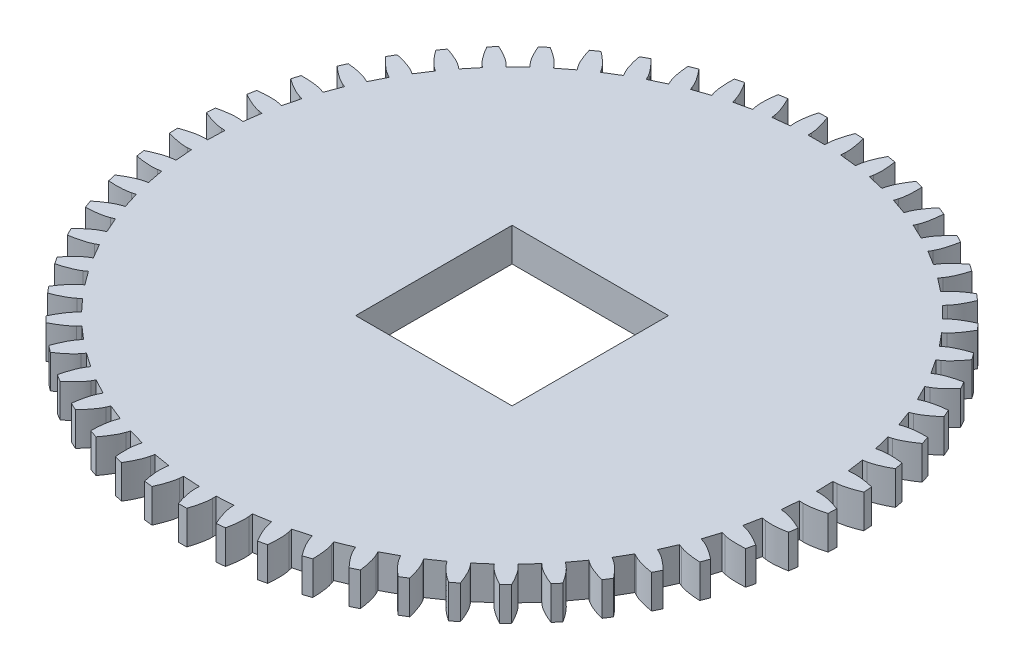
SolidWorks part; units mm, degrees
ref_plane "Front Plane" through (0, 0, 0) normal (0, 0, 1) x (1, 0, 0)
ref_plane "Top Plane" through (0, 0, 0) normal (0, 1, 0) x (1, 0, 0)
ref_plane "Right Plane" through (0, 0, 0) normal (1, 0, 0) x (0, 0, -1)
sketch "Sketch1" plane through (0, 0, 0) normal (0, 1, 0) x (1, 0, 0)
  line L0 (0, 0) -> (0, 13.7961) construction
  line L1 (0, 0) -> (-13.7961, 0) construction
  line L2 (0, 0) -> (-14.7444, -0.4064) construction
  line L3 (0, 0) -> (-13.7752, -0.76) construction
  line L4 (0, 0) -> (-13.7124, -1.5177) construction
  circle A0 centre (0, 0) radius 14.25 construction
  circle A1 centre (0, 0) radius 13.7961 construction
  circle A2 centre (0, 0) radius 13.625 construction
  circle A3 centre (0, 0) radius 14.75 construction
  spline S0 degree 4 poles (-13.7961, 0) (-13.82, 0) (-13.8868, -0.0025) (-14.0127, -0.0168) (-14.2161, -0.0538) (-14.4715, -0.1208) (-14.7955, -0.2298) (-15.1676, -0.3863) (-15.5644, -0.5872) (-15.9812, -0.8357) (-16.3823, -1.1095) (-16.7674, -1.4054) (-17.1366, -1.7208) (-17.5655, -2.1249) (-18.0534, -2.6418) (-18.582, -3.285) (-19.1302, -4.0656) (-19.6297, -4.8991) (-20.0717, -5.7639) (-20.4095, -6.5443) (-20.6648, -7.2257) (-20.8552, -7.803) (-20.9943, -8.2661) (-21.1519, -8.8561) (-21.2878, -9.4404) (-21.4031, -10.0472) (-21.5158, -10.7499) (-21.5908, -11.3826) (-21.6431, -11.9343) (-21.6852, -12.7113) (-21.6956, -13.1111) (-21.7009, -13.7341) (-21.6896, -14.0181) (-21.6847, -14.2699) (-21.68, -14.3453) (-21.678, -14.3998) (-21.677, -14.4291) knots 0 0 0 0 0 0.005377 0.015084 0.028532 0.04661 0.064855 0.092111 0.119476 0.146842 0.174209 0.201575 0.228941 0.256307 0.307035 0.361767 0.4165 0.471232 0.525964 0.580697 0.608063 0.635429 0.662795 0.690161 0.744894 0.77226 0.799626 0.854358 0.881725 0.909091 0.954545 0.977273 0.988636 0.994318 1 1 1 1 1 construction
  spline S1 degree 4 poles (-13.7961, 0) (-13.82, 0) (-13.8868, -0.0025) (-14.0127, -0.0168) (-14.2161, -0.0538) (-14.4715, -0.1208) (-14.7955, -0.2298) (-15.1676, -0.3863) (-15.5644, -0.5872) (-15.9812, -0.8357) (-16.3823, -1.1095) (-16.7674, -1.4054) (-17.1366, -1.7208) (-17.5655, -2.1249) (-18.0534, -2.6418) (-18.582, -3.285) (-19.1302, -4.0656) (-19.6297, -4.8991) (-20.0717, -5.7639) (-20.4095, -6.5443) (-20.6648, -7.2257) (-20.8552, -7.803) (-20.9943, -8.2661) (-21.1519, -8.8561) (-21.2878, -9.4404) (-21.4031, -10.0472) (-21.5158, -10.7499) (-21.5908, -11.3826) (-21.6431, -11.9343) (-21.6729, -12.4833) (-21.6821, -12.7051) (-21.6858, -12.8154) knots 0 0 0 0 0 0.005377 0.015084 0.028532 0.04661 0.064855 0.092111 0.119476 0.146842 0.174209 0.201575 0.228941 0.256307 0.307035 0.361767 0.4165 0.471232 0.525964 0.580697 0.608063 0.635429 0.662795 0.690161 0.744894 0.77226 0.799626 0.854358 0.881725 0.909091 0.909091 0.909091 0.909091 0.909091
  dimension "D1" = 29.5
  dimension "D2" = 28.5
  dimension "D3" = 27.5922
  dimension "D4" = 27.25
  dimension "D5" = 13.7961
  dimension "D6" = 1.579
  dimension "D7" = 3.158
  dimension "D8" = 6.316
sketch "Sketch2" plane through (0, 0, 0) normal (0, 1, 0) x (1, 0, 0)
  line L0 (0, 0) -> (-14.7444, -0.4064) construction
  line L1 (0, 0) -> (-14.7444, -0.4064) construction
  line L2 (0, 0) -> (-13.7752, -0.76) construction
  line L3 (0, 0) -> (-13.7961, 0) construction
  line L4 (0, 0) -> (-13.7124, -1.5177) construction
  line L5 (0, 0) -> (-13.7752, -0.76) construction
  line L6 (0, 0) -> (-13.7961, 0) construction
  line L7 (0, 0) -> (-13.7124, -1.5177) construction
  line L8 (-13.7752, -0.76) -> (-13.6043, -0.7506)
  line L9 (-13.6043, -0.7506) -> (-13.5423, -1.4989)
  line L10 (-13.5423, -1.4989) -> (-13.7124, -1.5177) construction
  line L11 (-13.5423, -1.4989) -> (-1.4909, -0.165)
  line L12 (-13.7961, 0) -> (-1.5, 0)
  circle A0 centre (0, 0) radius 13.625 construction
  circle A1 centre (0, 0) radius 13.7961 construction
  circle A2 centre (0, 0) radius 14.25 construction
  circle A3 centre (0, 0) radius 14.75 construction
  circle A4 centre (0, 0) radius 13.625 construction
  circle A5 centre (0, 0) radius 13.7961 construction
  circle A6 centre (0, 0) radius 14.25 construction
  circle A7 centre (0, 0) radius 14.75 construction
  arc A8 (-14.738, -0.5946) -> (-14.7484, -0.2182) centre (0, 0) cw
  circle A11 centre (0, 0) radius 1.5 construction
  arc A12 (-1.5, 0) -> (-1.4909, -0.165) centre (0, 0) ccw
  spline S0 degree 4 poles (-41.3241, -999.5754) (-10.3099, -24.6935) (-11.2108, -0.5621) (-12.7569, 0.2117) (-14.2161, -0.0538) (-14.4715, -0.1208) (-14.7955, -0.2298) (-15.1676, -0.3863) (-15.5644, -0.5872) (-15.9812, -0.8357) (-16.3823, -1.1095) (-16.7674, -1.4054) (-17.1366, -1.7208) (-17.5655, -2.1249) (-18.0534, -2.6418) (-18.582, -3.285) (-19.1302, -4.0656) (-19.6297, -4.8991) (-20.0717, -5.7639) (-20.4095, -6.5443) (-20.6648, -7.2257) (-20.8552, -7.803) (-20.9943, -8.2661) (-21.1519, -8.8561) (-21.2878, -9.4404) (-21.4031, -10.0472) (-21.5158, -10.7499) (-21.5908, -11.3826) (-21.7893, -13.476) (-21.7333, -17.6322) (-20.1746, 17.5146) (-53.8074, -1012.2419) knots -0.287698 -0.287698 -0.287698 -0.287698 -0.287698 0.005377 0.015084 0.028532 0.04661 0.064855 0.092111 0.119476 0.146842 0.174209 0.201575 0.228941 0.256307 0.307035 0.361767 0.4165 0.471232 0.525964 0.580697 0.608063 0.635429 0.662795 0.690161 0.744894 0.77226 0.799626 0.854358 0.881725 1.29146 1.29146 1.29146 1.29146 1.29146 only from (-13.7961, 0) to (-21.6858, -12.8154) construction
  spline S1 degree 4 poles (-13.7961, 0) (-13.82, 0) (-13.8868, -0.0025) (-14.0127, -0.0168) (-14.2161, -0.0538) (-14.4306, -0.11) (-14.6004, -0.1647) (-14.7122, -0.2048) (-14.7484, -0.2182) knots 0 0 0 0 0 0.005377 0.015084 0.028532 0.04661 0.05531 0.05531 0.05531 0.05531 0.05531
  spline S2 degree 4 poles (-13.7752, -0.76) (-13.799, -0.7613) (-13.8658, -0.7625) (-13.9923, -0.7552) (-14.1975, -0.7294) (-14.4147, -0.6851) (-14.5873, -0.6398) (-14.7011, -0.606) (-14.738, -0.5946) knots 0 0 0 0 0 0.005377 0.015084 0.028532 0.04661 0.05531 0.05531 0.05531 0.05531 0.05531
  point P21 (-13.6043, -0.7506)
  point P24 (-13.5423, -1.4989)
  dimension "D2" = 3
extrude "Boss-Extrude1" add sketch "Sketch2" along normal blind 1.5
pattern_circular "CirPattern1" count 57 over 360 of "Boss-Extrude1"
sketch "Sketch3" plane through (0, 1.5, 0) normal (0, 1, 0) x (1, 0, 0)
  line L1 (-3.5, -3.5) -> (3.5, -3.5)
  line L2 (-3.5, -3.5) -> (-3.5, 3.5)
  line L3 (-3.5, 3.5) -> (3.5, 3.5)
  line L4 (3.5, -3.5) -> (3.5, 3.5)
  line L5 (-3.5, -3.5) -> (3.5, 3.5) construction
  line L6 (-3.5, 3.5) -> (3.5, -3.5) construction
  point P0 (0, 0)
  dimension "D1" = 7
extrude "Cut-Extrude1" cut sketch "Sketch3" against normal up to surface (1.5 mm away)
equation "\"Module\"= .5"
equation "\"Number of Teeth\"= 57"
equation "\"Pressure Angle\"= 14.5deg"
equation "\"Pitch Diameter\"= \"Number of Teeth\" * \"Module\""
equation "\"Circular Pitch\"= pi * \"Module\""
equation "\"Addendum\"= \"Module\""
equation "\"Dedendum\"= 1.25 * \"Module\""
equation "\"Base Diameter\"= \"Pitch Diameter\" * cos ( \"Pressure Angle\" )"
equation "\"Base Radius\"= \"Base Diameter\" / 2"
equation "\"Width\"= 1.5"
equation "\"Outside Diameter\"= \"Pitch Diameter\" + 2 * \"Addendum\""
equation "\"D1@Sketch1\"=\"Outside Diameter\""
equation "\"D3@Sketch1\"=\"Base Diameter\""
equation "\"Root Diameter\"= \"Pitch Diameter\" - 2 * \"Dedendum\""
equation "\"D4@Sketch1\"=\"Root Diameter\""
equation "\"Tooth Angle\"= 360 / \"Number of Teeth\""
equation "\"D6@Sketch1\"=\"Tooth Angle\"/4"
equation "\"D7@Sketch1\"=\"Tooth Angle\"/2"
equation "\"D8@Sketch1\"=\"Tooth Angle\""
equation "\"D2@Sketch1\" = \"Pitch Diameter\""
equation "\"Shaft Diameter\"= 3"
equation "\"D1@CirPattern1\" = \"Number of Teeth\""
equation "\"D2@Sketch2\"= \"Shaft Diameter\""
equation "\"D1@Boss-Extrude1\" = \"Width\""
